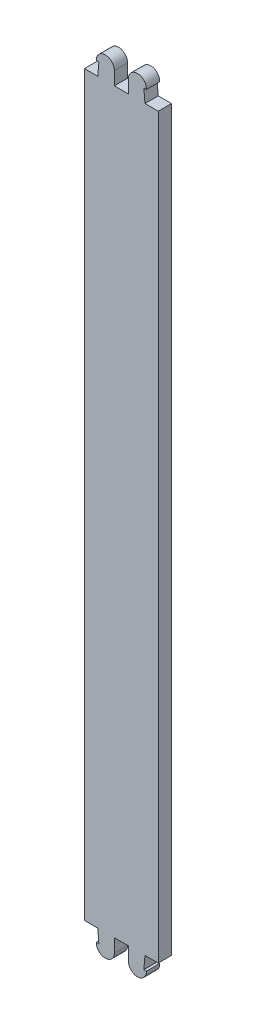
SolidWorks part; units mm, degrees
ref_plane "Front Plane" through (0, 0, 0) normal (0, 0, 1) x (1, 0, 0)
ref_plane "Top Plane" through (0, 0, 0) normal (0, 1, 0) x (1, 0, 0)
ref_plane "Right Plane" through (0, 0, 0) normal (1, 0, 0) x (0, 0, -1)
sketch "Sketch1" plane through (0, 0, 0) normal (0, 0, 1) x (1, 0, 0)
  line L0 (1.5, 37.5) -> (1.5, 40.2) construction
  line L1 (7.5053, -37.5) -> (-7.5053, -37.5) construction
  line L2 (7.5053, -112.5) -> (7.5053, 37.5)
  line L3 (7.5053, 37.5) -> (4.8001, 37.5)
  line L4 (-7.5053, -112.5) -> (-7.5053, 37.5)
  line L5 (7.5053, -37.5) -> (-7.5053, 37.5) construction
  line L6 (7.5053, 37.5) -> (-7.5053, -37.5) construction
  line L7 (4.5, 37.5) -> (4.5, 40.2) construction
  line L8 (4.5, 40.2) -> (5.0297, 40.2) construction
  line L9 (0, 0) -> (0, 30.8513) construction
  line L10 (5.0297, 40.2) -> (5.0297, 37.5) construction
  line L11 (1.43, 37.5) -> (1.43, 40.2)
  line L12 (4.57, 40.13) -> (5.0984, 40.13)
  line L14 (1.43, 37.5) -> (1.43, 40.2) construction
  line L16 (-4.57, 40.13) -> (-5.0984, 40.13)
  line L17 (-1.43, 37.5) -> (-1.43, 40.2)
  line L18 (-1.43, 37.5) -> (-4.57, 37.5) construction
  line L19 (-4.8001, 37.5) -> (-7.5053, 37.5)
  line L20 (4.5, 37.5) -> (1.5, 37.5) construction
  line L21 (1.43, 37.5) -> (-1.43, 37.5)
  line L22 (1.5, 37.5) -> (1.43, 37.5) construction
  line L23 (4.57, 37.5) -> (4.5, 37.5) construction
  line L24 (-4.8001, -112.5) -> (-7.5053, -112.5)
  line L26 (-4.57, -115.13) -> (-5.0984, -115.13)
  line L27 (-1.43, -112.5) -> (-1.43, -115.2)
  line L28 (1.43, -112.5) -> (-1.43, -112.5)
  line L29 (1.43, -112.5) -> (1.43, -115.2)
  line L30 (4.57, -115.13) -> (5.0984, -115.13)
  line L32 (7.5053, -112.5) -> (4.8001, -112.5)
  line L33 (4.8001, 37.5) -> (4.57, 40.13)
  line L34 (-4.8001, 37.5) -> (-4.57, 40.13)
  line L35 (4.57, 37.5) -> (4.57, 40.13) construction
  line L36 (-4.8001, -112.5) -> (-4.57, -115.13)
  line L37 (4.8001, -112.5) -> (4.57, -115.13)
  arc A0 (5.0297, 40.2) -> (1.5, 40.2) centre (3.2649, 40.2) ccw construction
  arc A1 (5.0984, 40.13) -> (1.43, 40.2) centre (3.2649, 40.2) ccw
  arc A2 (-5.0984, 40.13) -> (-1.43, 40.2) centre (-3.2649, 40.2) cw
  arc A3 (-5.0984, -115.13) -> (-1.43, -115.2) centre (-3.2649, -115.2) ccw
  arc A4 (5.0984, -115.13) -> (1.43, -115.2) centre (3.2649, -115.2) cw
  point P0 (0, 0)
extrude "Boss-Extrude1" add sketch "Sketch1" along normal blind 2.7
ref_plane "Plano1" through (1.43, -112.5, 2.7) normal (-1, 0, 0) x (0, 0, 1)
equation "\"Thick\"= 2.7"
equation "\"h\"= 3"
equation "\"kerf\" = .14"
equation "\"Length\"= \"Thick\""
equation "\"D4@Sketch1\"= \"h\""
equation "\"D5@Sketch1\" = \"h\""
equation "\"Deflection\"= .4 * \"Thick\""
equation "\"D8@Sketch1\"=\"kerf\"/2"
equation "\"D1@Boss-Extrude1\"=\"Thick\""
equation "\"Strain\"= \"Deflection\" / \"Length\""
equation "\"D3@Sketch1\"=\"Length\""
equation "\"Per_def\"= 1.09 * ( \"Strain\" * \"Length\" * \"Length\" ) / \"h\""
equation "\"D6@Sketch1\" = \"h\" * .5"
equation "\"D2@Sketch1\"= \"Per_def\" / 2"
equation "\"ancho_total\"= 10 + \"kerf\" / 2"
equation "\"angulo_nuevo\"=95"
equation "\"D10@Sketch1\"=\"angulo_nuevo\""
